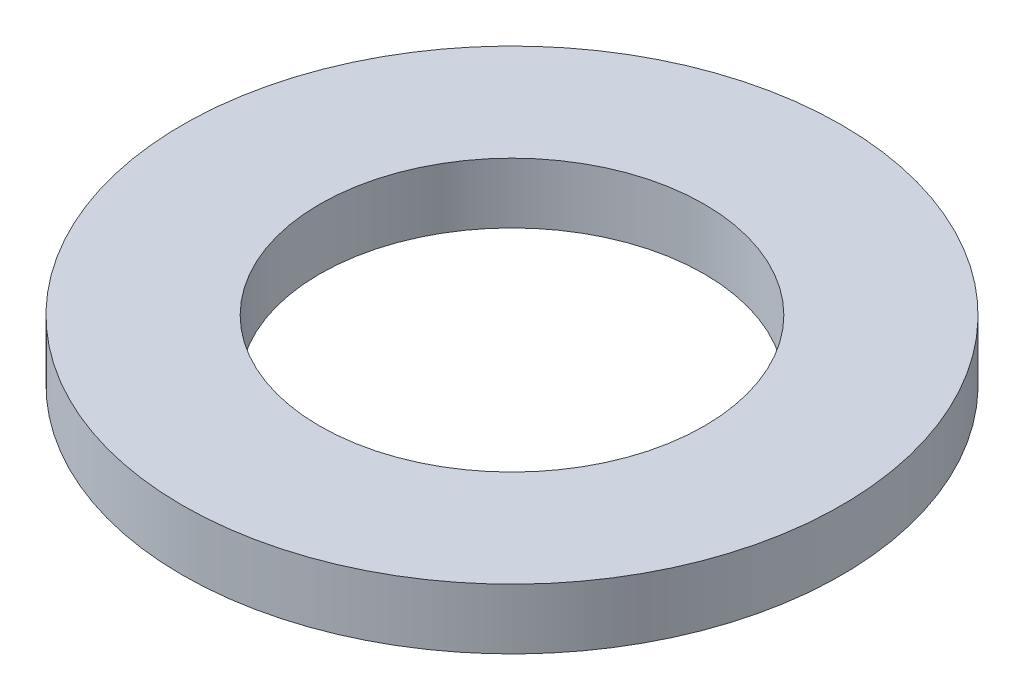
SolidWorks part; units mm, degrees
ref_plane "Plan de face" through (0, 0, 0) normal (0, 0, 1) x (1, 0, 0)
ref_plane "Plan de dessus" through (0, 0, 0) normal (0, 1, 0) x (1, 0, 0)
ref_plane "Plan de droite" through (0, 0, 0) normal (1, 0, 0) x (0, 0, -1)
sketch "Esquisse1" plane through (0, 0, 0) normal (0, 1, 0) x (1, 0, 0)
  circle A0 centre (0, 0) radius 7
  circle A1 centre (0, 0) radius 12
  dimension "D1" = 14
  dimension "D2" = 24
extrude "Extrusion1" add sketch "Esquisse1" along normal blind 2.2
